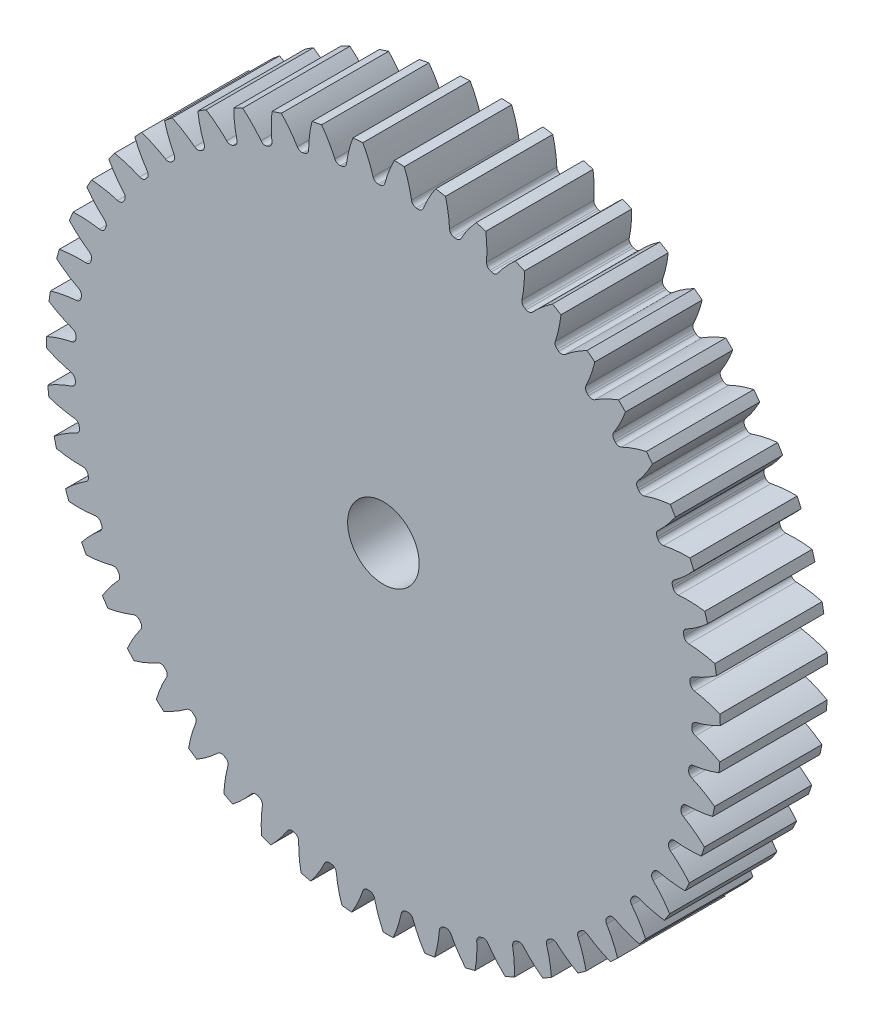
SolidWorks part; units mm, degrees
ref_plane "Front" through (0, 0, 0) normal (0, 0, 1) x (1, 0, 0)
ref_plane "Top" through (0, 0, 0) normal (0, 1, 0) x (1, 0, 0)
ref_plane "Right" through (0, 0, 0) normal (1, 0, 0) x (0, 0, -1)
sketch "Sketch3" plane through (0, 0, 0) normal (0, 0, 1) x (1, 0, 0)
  circle A0 centre (0, 0) radius 299.1556
  dimension "od" = 598.3111
extrude "gearBody" add sketch "Sketch3" along normal blind 95.25
sketch "Sketch2" plane through (0, 0, 0) normal (0, 0, 1) x (1, 0, 0)
  line L0 (0, 0) -> (249.9151, 103.5182) construction
  line L1 (298.6903, -19.0353) -> (0, 0) construction
  line L2 (0, 0) -> (36.3143, 0) construction
  line L3 (287.8377, 4.0858) -> (287.5465, -13.5739) construction
  line L5 (287.6921, -4.744) -> (0, 0) construction
  line L7 (0, 0) -> (270.5062, 0) construction
  arc A0 (270.5047, -0.8896) -> (270.387, -8.0297) centre (0, 0) ccw construction
  arc A1 (299.017, 9.1046) -> (298.5542, -18.9585) centre (0, 0) ccw construction
  arc A2 (287.8377, 4.0858) -> (287.5465, -13.5739) centre (0, 0) ccw construction
  arc A3 (273.7044, -5.2915) -> (273.7301, -3.7357) centre (0, 0) ccw
  arc A4 (298.6903, -19.0353) -> (276.9765, -9.7807) centre (246.3662, -111.7019) ccw
  arc A5 (298.6903, -19.0353) -> (299.1556, 9.1768) centre (0, 0) ccw
  arc A6 (299.1556, 9.1768) -> (277.1484, 0.6432) centre (249.9151, 103.5182) cw
  arc A7 (273.7301, -3.7357) -> (277.1484, 0.6432) centre (278.3242, -3.7984) cw
  arc A8 (276.9765, -9.7807) -> (273.7044, -5.2915) centre (278.2981, -5.3803) cw
  point P6 (299.1556, 9.1768)
  point P22 (298.6903, -19.0353)
  dimension "baseDia" = 541.0124
  dimension "od" = 598.3111
  dimension "pd" = 575.7333
  dimension "rd" = 547.5111
  dimension "rFillet" = 4.5946
  dimension "pointX" = 299.1556
  dimension "pointY" = 9.1768
  dimension "CTT" = 17.6597
  dimension "flankCenterAngle" = 22.5
extrude "toothCut" cut sketch "Sketch2" along normal through all
pattern_circular "CirPattern1" count 51 over 360 about axis through (0, 0, 0) along (0, 0, 1) of "toothCut"
sketch "hub1Dia" plane through (0, 0, 0) normal (0, 0, -1) x (-1, 0, 0)
  circle A0 centre (0, 0) radius 12.7
  dimension "hub1Dia" = 25.4
sketch "hub2Dia" plane through (0, 0, 95.25) normal (0, 0, 1) x (1, 0, 0)
  circle A0 centre (0, 0) radius 12.7
  dimension "hub2dia" = 25.4
sketch "boreDia" plane through (0, 0, 0) normal (0, 0, 1) x (1, 0, 0)
  circle A0 centre (0, 0) radius 31.75
  dimension "boreDia" = 63.5
extrude "bore" cut sketch "boreDia" against normal mid plane 25400
